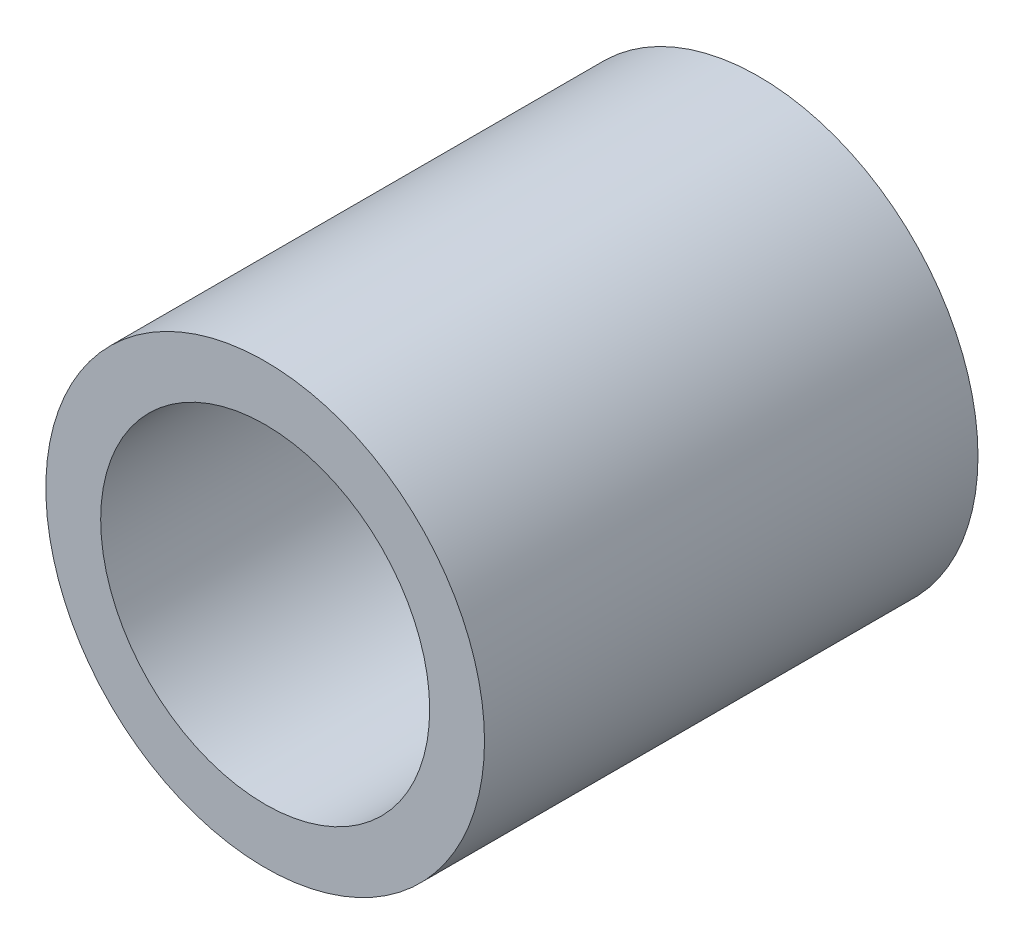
SolidWorks part; units mm, degrees
ref_plane "Plane1" through (0, 0, 0) normal (0, 0, 1) x (1, 0, 0)
ref_plane "Plane2" through (0, 0, 0) normal (0, 1, 0) x (1, 0, 0)
ref_plane "Plane3" through (0, 0, 0) normal (1, 0, 0) x (0, 0, -1)
sketch "Sketch1" plane through (0, 0, 0) normal (0, 0, 1) x (1, 0, 0)
  circle A0 centre (0, 0) radius 12.7
  dimension "D1" = 25.4
extrude "Base-Extrude" add sketch "Sketch1" along normal up to surface (28.575 mm away)
sketch "Sketch2" plane through (0, 0, 28.575) normal (0, 0, 1) x (1, 0, 0)
  circle A0 centre (0, 0) radius 9.525
  dimension "D1" = 19.05
extrude "Cut-Extrude1" cut sketch "Sketch2" against normal through all
